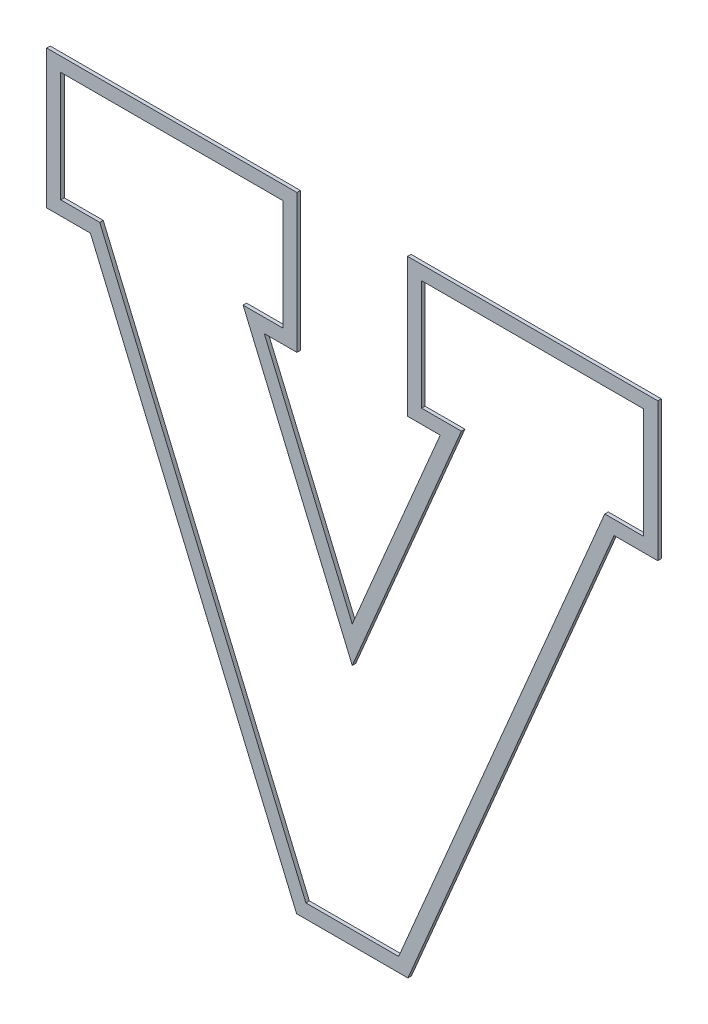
SolidWorks part; units mm, degrees
ref_plane "Front Plane" through (0, 0, 0) normal (0, 0, 1) x (1, 0, 0)
ref_plane "Top Plane" through (0, 0, 0) normal (0, 1, 0) x (1, 0, 0)
ref_plane "Right Plane" through (0, 0, 0) normal (1, 0, 0) x (0, 0, -1)
sketch "Sketch1" plane through (0, 0, 0) normal (0, 0, 1) x (1, 0, 0)
  line B0 (326.5754, 440.106) -> (356.1251, 440.106)
  line B1 (356.1251, 440.106) -> (276.5171, 252.3248)
  line B2 (276.5171, 252.3248) -> (196.9092, 440.106)
  line B3 (196.9092, 440.106) -> (226.4589, 440.106)
  line B4 (226.4589, 440.106) -> (226.4589, 565.4544)
  line B5 (226.4589, 565.4544) -> (0, 565.4544)
  line B6 (0, 565.4544) -> (0, 440.106)
  line B7 (0, 440.106) -> (39.5592, 440.106)
  line B8 (39.5592, 440.106) -> (226.1378, 0)
  line B9 (226.1378, 0) -> (326.8965, 0)
  line B10 (326.8965, 0) -> (513.4751, 440.106)
  line B11 (513.4751, 440.106) -> (553.0343, 440.106)
  line B12 (553.0343, 440.106) -> (553.0343, 565.4544)
  line B13 (553.0343, 565.4544) -> (326.5754, 565.4544)
  line B14 (326.5754, 565.4544) -> (326.5754, 440.106)
  line B15 (318.4864, 12.7) -> (234.5479, 12.7)
  line B16 (505.065, 452.806) -> (318.4864, 12.7)
  line B17 (540.3343, 452.806) -> (505.065, 452.806)
  line B18 (540.3343, 552.7544) -> (540.3343, 452.806)
  line B19 (339.2754, 552.7544) -> (540.3343, 552.7544)
  line B20 (339.2754, 452.806) -> (339.2754, 552.7544)
  line B21 (375.3033, 452.806) -> (339.2754, 452.806)
  line B22 (276.5171, 219.7869) -> (375.3033, 452.806)
  line B23 (177.731, 452.806) -> (276.5171, 219.7869)
  line B24 (213.7589, 452.806) -> (177.731, 452.806)
  line B25 (213.7589, 552.7544) -> (213.7589, 452.806)
  line B26 (12.7, 552.7544) -> (213.7589, 552.7544)
  line B27 (12.7, 452.806) -> (12.7, 552.7544)
  line B28 (47.9692, 452.806) -> (12.7, 452.806)
  line B29 (234.5479, 12.7) -> (47.9692, 452.806)
sketch_block_instance "V_Block-1"
sketch_block "V_Block"
extrude "Boss-Extrude1" add sketch "Sketch1" along normal blind 3.175
